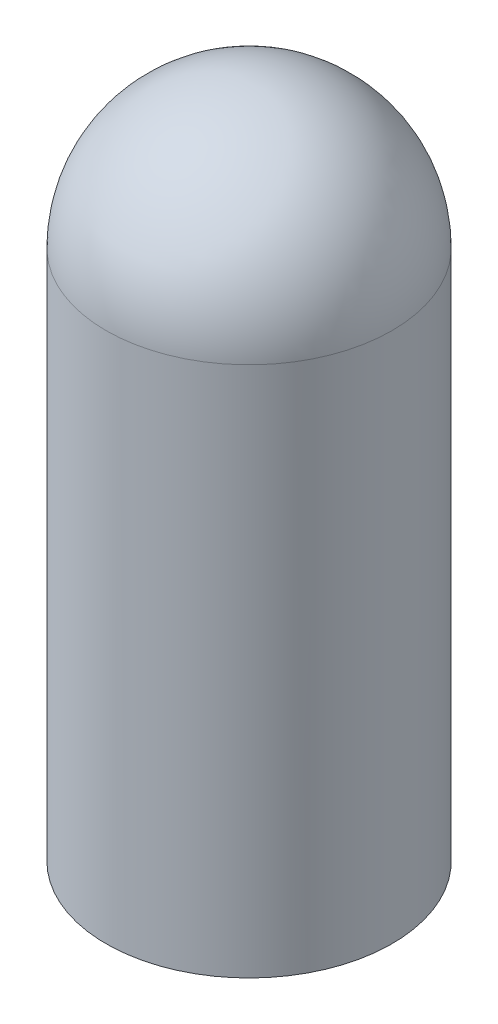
SolidWorks part; units mm, degrees
ref_plane "Front Plane" through (0, 0, 0) normal (0, 0, 1) x (1, 0, 0)
ref_plane "Top Plane" through (0, 0, 0) normal (0, 1, 0) x (1, 0, 0)
ref_plane "Right Plane" through (0, 0, 0) normal (1, 0, 0) x (0, 0, -1)
sketch "Sketch1" plane through (0, 0, 0) normal (0, 0, 1) x (1, 0, 0)
  line L0 (0, 0) -> (0, 33.02) construction
  line L1 (8.89, 33.02) -> (8.89, 0)
  line L2 (8.89, 0) -> (0, 0)
  line L3 (0, 0) -> (0, 41.91)
  arc A0 (8.89, 33.02) -> (0, 41.91) centre (0, 33.02) ccw
revolve "Revolve1" add sketch "Sketch1" angle 360 about L0
